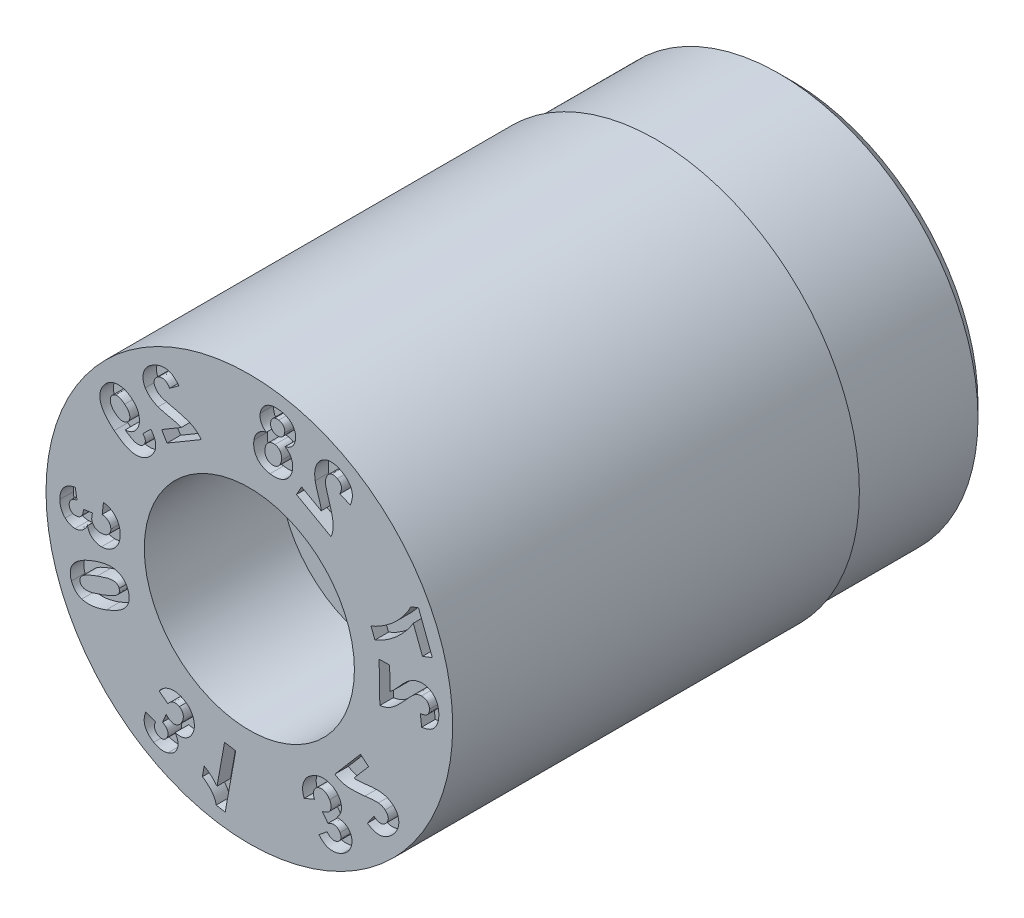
SolidWorks part; units mm, degrees
ref_plane "Front Plane" through (0, 0, 0) normal (0, 0, 1) x (1, 0, 0)
ref_plane "Top Plane" through (0, 0, 0) normal (0, 1, 0) x (1, 0, 0)
ref_plane "Right Plane" through (0, 0, 0) normal (1, 0, 0) x (0, 0, -1)
sketch "Sketch1" plane through (0, 0, 0) normal (1, 0, 0) x (0, 0, -1)
  line L2 (0, 3) -> (0, 1.55)
  line L3 (7.75, 3) -> (0, 3)
  line L4 (-3.7979, 0) -> (49996.2021, 0) construction
  line L8 (8, 0.8) -> (2, 0.8)
  line L9 (2, 1.55) -> (2, 0.8)
  line L10 (2, 1.55) -> (0, 1.55)
  line L12 (8, 0.8) -> (8, 2.75)
  line L16 (8, 2.75) -> (7.75, 3)
  dimension "D1" = 8
  dimension "D2" = 45
  dimension "D3" = 0.25
  dimension "D4" = 6
  dimension "D5" = 3.1
  dimension "D6" = 2
  dimension "D7" = 1.6
revolve "Revolve1" add sketch "Sketch1" angle 360 about L4
sketch "Sketch4" plane through (0, 0, 0) normal (1, 0, 0) x (0, 0, -1)
  line L0 (0, 0) -> (50000, 0) construction
  line L1 (8, -2.75) -> (8, 2.75) construction
  line L2 (6, 3.935) -> (8, 3.935)
  line L3 (6, 3.935) -> (6, 2.935)
  line L4 (6, 2.935) -> (8, 2.935)
  line L5 (8, 3.935) -> (8, 2.935)
  line L6 (7.75, 3) -> (0, 3) construction
  line L9 (0, 3.3) -> (0, -3.3) construction
  dimension "D1" = 1
  dimension "D2" = 0.065
  dimension "D3" = 6
revolve "Cut-Revolve1" cut sketch "Sketch4" angle 360 about L0
sketch "Sketch6" plane through (0, 0, 0) normal (0, 0, 1) x (1, 0, 0)
  arc A0 (1.9256, -0.3008) -> (1.834, -0.6594) centre (0, 0) ccw construction
  text T0 "27  28  29  30  31  32" font "Arial" height 0.88
extrude "Cut-Extrude1" cut sketch "Sketch6" against normal blind 0.2
